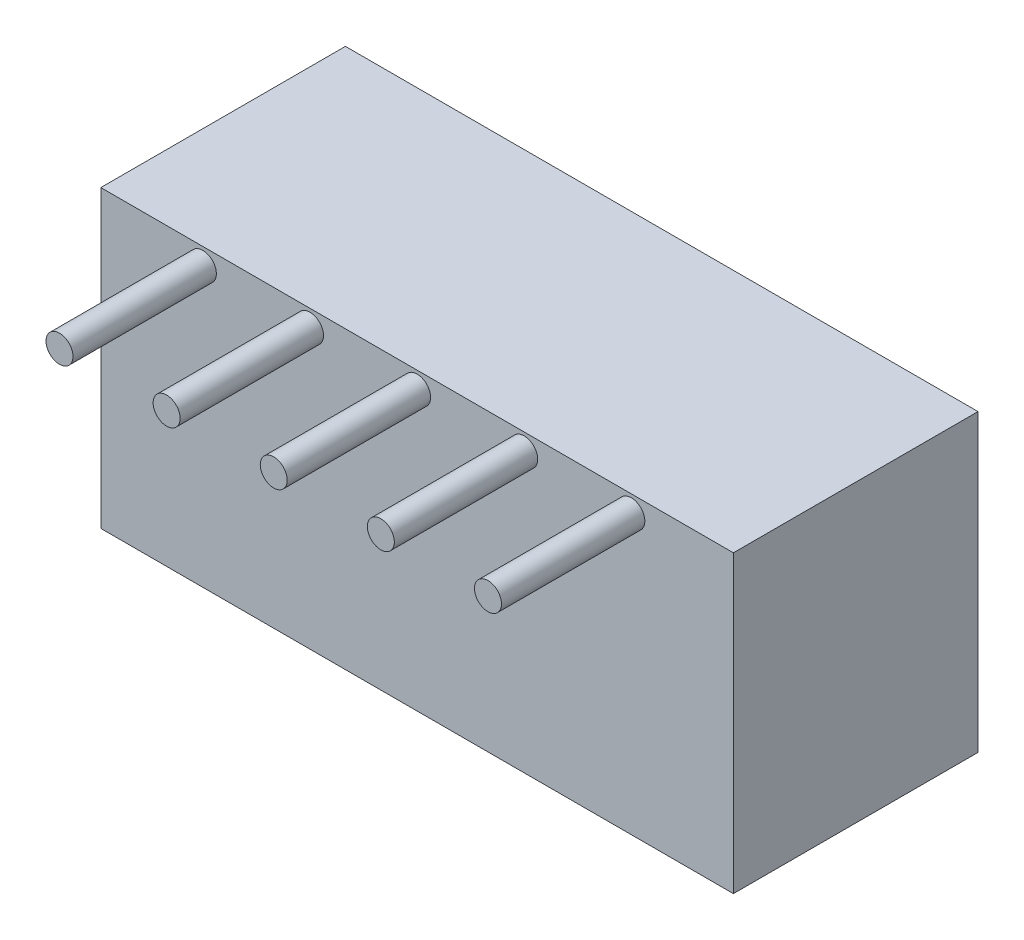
SolidWorks part; units mm, degrees
ref_plane "前视基准面" through (0, 0, 0) normal (0, 0, 1) x (1, 0, 0)
ref_plane "上视基准面" through (0, 0, 0) normal (0, 1, 0) x (1, 0, 0)
ref_plane "右视基准面" through (0, 0, 0) normal (1, 0, 0) x (0, 0, -1)
sketch "Sketch1" plane through (0, 0, 0) normal (0, 0, 1) x (1, 0, 0)
  line L1 (0, 0) -> (15, 0)
  line L2 (0, 0) -> (0, 7)
  line L3 (0, 7) -> (15, 7)
  line L4 (15, 0) -> (15, 7)
extrude "Boss-Extrude1" add sketch "Sketch1" along normal blind 5.8
sketch "Sketch2" plane through (0, 0, 5.8) normal (0, 0, 1) x (1, 0, 0)
  line L0 (0, 3.5) -> (16.7155, 3.5) construction
  line L1 (0, 7) -> (0, 0) construction
  line L2 (7.5, 7) -> (7.5, -1.9043) construction
  line L3 (15, 7) -> (0, 7) construction
  circle A0 centre (2.42, 6.6) radius 0.32
  circle A1 centre (4.96, 6.6) radius 0.32
  circle A2 centre (7.5, 6.6) radius 0.32
  circle A3 centre (10.04, 6.6) radius 0.32
  circle A4 centre (12.58, 6.6) radius 0.32
  dimension "D1" = 0.64
  dimension "D2" = 0.4
  dimension "D3" = 5.08
  dimension "D4" = 5
extrude "Boss-Extrude2" add sketch "Sketch2" along normal blind 3.4
shell "Shell2" thickness 0.4
sketch "Sketch3" plane through (0, 7, 0) normal (0, 1, 0) x (1, 0, 0)
  line L0 (0, -2.9) -> (16.1027, -2.9) construction
  line L1 (0, -5.8) -> (0, 0) construction
  line L2 (7.5, 0) -> (7.5, -5.8) construction
  line L3 (15, 0) -> (0, 0) construction
  line L4 (15, -5.8) -> (0, -5.8) construction
  circle A0 centre (2.42, -2.9) radius 0.32
  circle A1 centre (4.96, -2.9) radius 0.32
  circle A2 centre (7.5, -2.9) radius 0.32
  circle A3 centre (10.04, -2.9) radius 0.32
  circle A4 centre (12.58, -2.9) radius 0.32
  dimension "D1" = 0.64
  dimension "D2" = 5.08
  dimension "D3" = 5
extrude "Boss-Extrude3" add sketch "Sketch3" against normal blind 6
